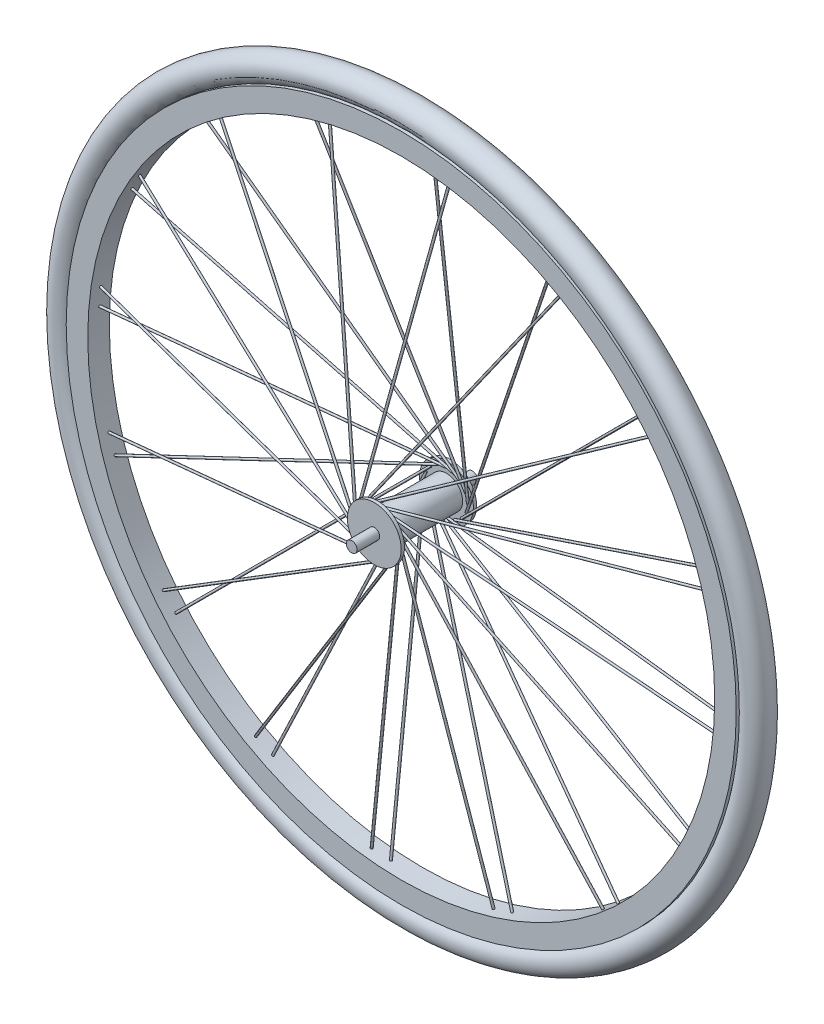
SolidWorks part; units mm, degrees
ref_plane "Alzado" through (0, 0, 0) normal (0, 0, 1) x (1, 0, 0)
ref_plane "Planta" through (0, 0, 0) normal (0, 1, 0) x (1, 0, 0)
ref_plane "Vista lateral" through (0, 0, 0) normal (1, 0, 0) x (0, 0, -1)
sketch "Sk_Eje" plane through (0, 0, 0) normal (0, 0, 1) x (1, 0, 0)
  circle A0 centre (0, 0) radius 5
  point P0 (0, 0)
  dimension "D1" = 10
extrude "Eje" add sketch "Sk_Eje" along normal blind 106 and the other way blind 6
sketch "Sk_Buje" plane through (0, 0, 0) normal (0, 0, 1) x (1, 0, 0)
  circle A0 centre (0, 0) radius 15
  point P0 (0, 0)
  dimension "D1" = 30
extrude "Buje" add sketch "Sk_Buje" along normal blind 70 from offset 15
sketch "Sk_Pestana_izq" plane through (0, 0, 0) normal (0, 0, 1) x (1, 0, 0)
  circle A0 centre (0, 0) radius 25
  point P0 (0, 0)
  dimension "D1" = 50
extrude "Pestana_izq" add sketch "Sk_Pestana_izq" along normal blind 3 from offset 15
sketch "Sk_Pestana_dcha" plane through (0, 0, 0) normal (0, 0, 1) x (1, 0, 0)
  circle A0 centre (0, 0) radius 25
  point P0 (0, 0)
  dimension "D1" = 50
extrude "Pestana_dcha" add sketch "Sk_Pestana_dcha" along normal blind 3 from offset 82
sketch "Sk_Llanta" plane through (0, 0, 0) normal (0, 0, 1) x (1, 0, 0)
  circle A0 centre (0, 0) radius 311
  circle A1 centre (0, 0) radius 291
  point P0 (0, 0)
  dimension "D1" = 622
  dimension "D2" = 582
extrude "Llanta" add sketch "Sk_Llanta" along normal blind 20 from offset 40
sketch "Sk_Cubierta" plane through (0, 0, 0) normal (0, 1, 0) x (1, 0, 0)
  line L0 (0, 950) -> (0, -1050) construction
  circle A0 centre (321.5, -50) radius 12.5
  point P0 (0, 0)
  dimension "D1" = 25
  dimension "D2" = 321.5
  dimension "D3" = 50
revolve "Cubierta" add sketch "Sk_Cubierta" angle 360 about L0
sketch3d "Eje_Radio_izq"
  line L0 (0, 20, 18) -> (-294.327, 20, 50)
  point P2 (-147.1635, 20, 34)
ref_plane "Plano_Radio_izq" through (-147.1635, 20, 34) normal (-0.9941, 0, 0.1081) x (0.1081, 0, 0.9941)
sketch "Sk_Radio_izq" plane through (-147.1635, 20, 34) normal (-0.9941, 0, 0.1081) x (0.1081, 0, 0.9941)
  circle A0 centre (0, 0) radius 1
extrude "Radio_izq" add sketch "Sk_Radio_izq" along normal mid plane 296.0615
sketch3d "Eje_Matriz_radios_izq"
  line L0 (0, 0, -500) -> (0, 0, 500)
pattern_circular "Matriz_radios_izq" count 16 over 360 about axis through (0, 0, 0) along (0, 0, 1) of "Radio_izq"
sketch3d "Eje_Radio_dcha"
  line L0 (3.902, 19.616, 82) -> (292.57, -37.805, 50)
  point P2 (148.236, -9.0945, 66)
ref_plane "Plano_Radio_dcha" through (148.236, -9.0945, 66) normal (0.975, -0.194, -0.1081) x (-0.106, 0.0211, -0.9941)
sketch "Sk_Radio_dcha" plane through (148.236, -9.0945, 66) normal (0.975, -0.194, -0.1081) x (-0.106, 0.0211, -0.9941)
  circle A0 centre (0, 0) radius 1
extrude "Radio_dcha" add sketch "Sk_Radio_dcha" along normal mid plane 296.0581
sketch3d "Eje_Matriz_radios_dcha"
  line L0 (0, 0, -500) -> (0, 0, 500)
pattern_circular "Matriz_radios_dcha" count 16 over 360 about axis through (0, 0, 0) along (0, 0, 1) of "Radio_dcha"
equation "\"diametro_cubierta\"= 668"
equation "\"longitud_eje\"= 100"
equation "\"ancho_buje\"= 70"
equation "\"diametro_llanta\"= 622"
